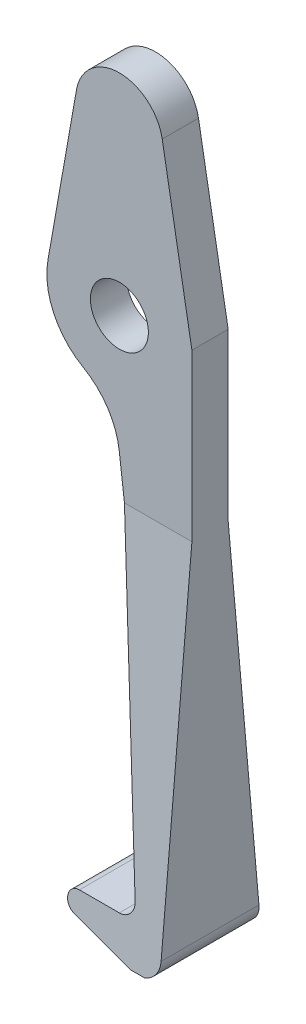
SolidWorks part; units mm, degrees
ref_plane "Front Plane" through (0, 0, 0) normal (0, 0, 1) x (1, 0, 0)
ref_plane "Top Plane" through (0, 0, 0) normal (0, 1, 0) x (1, 0, 0)
ref_plane "Right Plane" through (0, 0, 0) normal (1, 0, 0) x (0, 0, -1)
sketch "Sketch1" plane through (0, 0, 0) normal (0, 0, 1) x (1, 0, 0)
  line L0 (-9.8476, 1.7391) -> (-5.9086, 24.0435)
  line L1 (5.9086, 24.0435) -> (10, 0.8762)
  line L2 (10, 0.8762) -> (10, -70)
  line L3 (6.0729, -72.8532) -> (-1.9635, -70.242)
  line L5 (-1.5, -67.3154) -> (4, -67.3154)
  line L6 (5.9851, -65.0716) -> (-0.0241, -16.1308)
  line L7 (0, 0) -> (0, 27.1361) construction
  arc A0 (-9.8476, 1.7391) -> (-4.9748, -8.6748) centre (0, 0) ccw
  arc A1 (5.9086, 24.0435) -> (-5.9086, 24.0435) centre (0, 23) ccw
  arc A2 (10, -70) -> (6.0729, -72.8532) centre (7, -70) cw
  arc A3 (-1.9635, -70.242) -> (-1.5, -67.3154) centre (-1.5, -68.8154) cw
  arc A4 (5.9851, -65.0716) -> (4, -67.3154) centre (4, -65.3154) cw
  arc A5 (-4.9748, -8.6748) -> (-0.0241, -16.1308) centre (-9.9495, -17.3495) cw
  dimension "D2" = 6
  dimension "D3" = 23
  dimension "D4" = 3
  dimension "D5" = 102
  dimension "D6" = 1.5
  dimension "D7" = 2
  dimension "D8" = 10
  dimension "D10" = 10
  dimension "D12" = 6
  dimension "D14" = 10
  dimension "D9" = 13
  dimension "D11" = 18
  dimension "D13" = 7
extrude "Extrude1" add sketch "Sketch1" along normal mid plane 14
sketch "Sketch2" plane through (0, 0, 0) normal (1, 0, 0) x (0, 0, -1)
  line L0 (0, -76.7203) -> (0, 32.2314) construction
  line L1 (2.5, 29) -> (-2.5, 29)
  line L2 (-2.5, 29) -> (-2.5, -22)
  line L3 (-2.5, -22) -> (-7, -72.8532)
  line L4 (-7, -72.8532) -> (7, -72.8532)
  line L5 (7, 29) -> (-7, 29) construction
  line L7 (2.5, 29) -> (2.5, -22)
  line L8 (2.5, -22) -> (7, -72.8532)
  point P12 (0, 29)
  point P14 (0, -72.8532)
  dimension "D1" = 51
  dimension "D2" = 2.5
extrude "Cut-Extrude1" cut sketch "Sketch2" against normal through all and the other way through all flip side to cut
hole_wizard "M8.0 (8.000000) Diameter Hole1" positions "Sketch4" profile "Sketch3" hole size "M8.0" standard "ISO"
sketch "Sketch4" plane through (0, 0, 2.5) normal (0, 0, 1) x (1, 0, 0)
  point P0 (0, 0)
sketch "Sketch3" plane through (0, 0, 2.5) normal (1, 0, 0) x (0, -1, 0)
  line L0 (0, 0) -> (0, 9.5)
  line L1 (0, 9.5) -> (4, 9.5)
  line L2 (4, 9.5) -> (4, 0)
  line L5 (4, 0) -> (0, 0)
  line L11 (0, -6.35) -> (0, 107.95) construction
  dimension "Thru Hole Dia." = 8
  dimension "Thru Hole Depth" = 9.5
